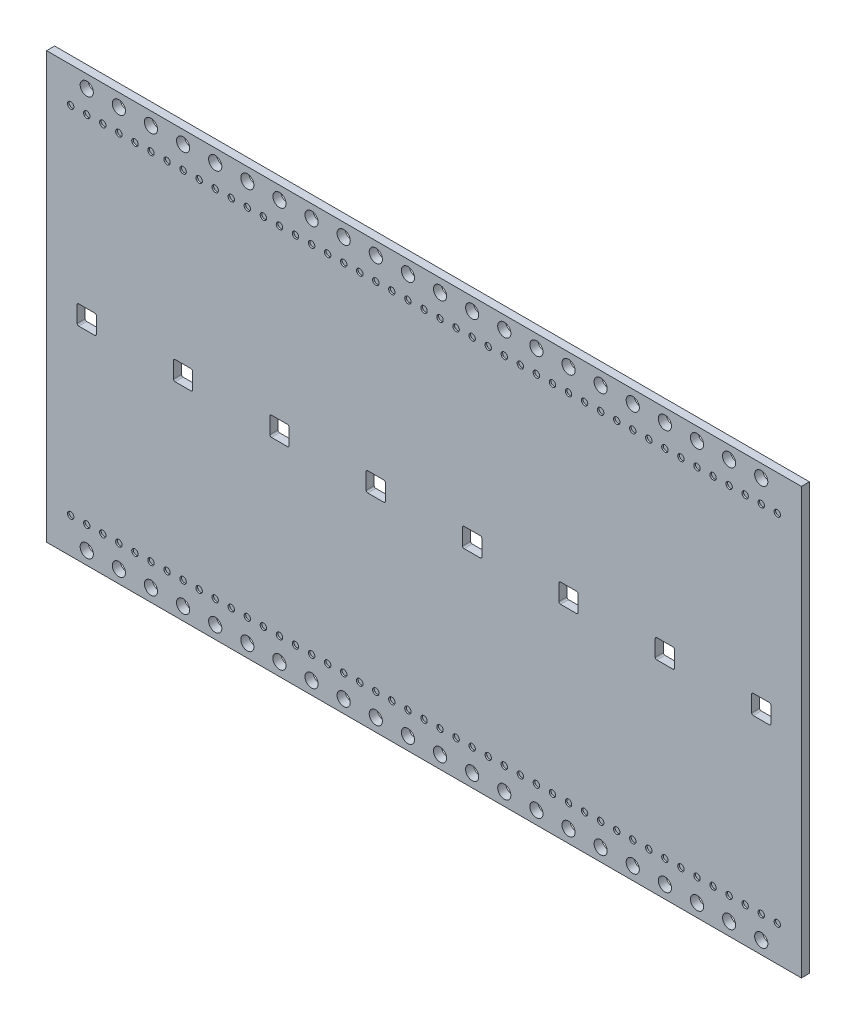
SolidWorks part; units mm, degrees
ref_plane "前视基准面" through (0, 0, 0) normal (0, 0, 1) x (1, 0, 0)
ref_plane "上视基准面" through (0, 0, 0) normal (0, 1, 0) x (1, 0, 0)
ref_plane "右视基准面" through (0, 0, 0) normal (1, 0, 0) x (0, 0, -1)
sketch "草图1" plane through (0, 0, 0) normal (0, 0, 1) x (1, 0, 0)
  line L0 (-117.5, 66.275) -> (117.5, 66.275)
  line L1 (117.5, -66.275) -> (-117.5, -66.275)
  line L2 (-117.5, -66.275) -> (-117.5, 66.275)
  line L3 (117.5, 66.275) -> (117.5, -66.275)
  line L4 (117.5, 66.275) -> (-117.5, -66.275) construction
  circle A0 centre (-105, 62.275) radius 2.05
  circle A1 centre (-95, 62.275) radius 2.05
  circle A2 centre (-95, -62.275) radius 2.05
  circle A3 centre (-85, 62.275) radius 2.05
  circle A4 centre (-85, -62.275) radius 2.05
  circle A5 centre (-75, 62.275) radius 2.05
  circle A6 centre (-75, -62.275) radius 2.05
  circle A7 centre (-65, 62.275) radius 2.05
  circle A8 centre (-65, -62.275) radius 2.05
  circle A9 centre (-55, 62.275) radius 2.05
  circle A10 centre (-55, -62.275) radius 2.05
  circle A11 centre (-45, 62.275) radius 2.05
  circle A12 centre (-45, -62.275) radius 2.05
  circle A13 centre (-35, 62.275) radius 2.05
  circle A14 centre (-35, -62.275) radius 2.05
  circle A15 centre (-25, 62.275) radius 2.05
  circle A16 centre (-25, -62.275) radius 2.05
  circle A17 centre (-15, 62.275) radius 2.05
  circle A18 centre (-15, -62.275) radius 2.05
  circle A19 centre (-5, 62.275) radius 2.05
  circle A20 centre (-5, -62.275) radius 2.05
  circle A21 centre (5, 62.275) radius 2.05
  circle A22 centre (5, -62.275) radius 2.05
  circle A23 centre (15, 62.275) radius 2.05
  circle A24 centre (15, -62.275) radius 2.05
  circle A25 centre (25, 62.275) radius 2.05
  circle A26 centre (25, -62.275) radius 2.05
  circle A27 centre (35, 62.275) radius 2.05
  circle A28 centre (35, -62.275) radius 2.05
  circle A29 centre (45, 62.275) radius 2.05
  circle A30 centre (45, -62.275) radius 2.05
  circle A31 centre (55, 62.275) radius 2.05
  circle A32 centre (55, -62.275) radius 2.05
  circle A33 centre (65, 62.275) radius 2.05
  circle A34 centre (65, -62.275) radius 2.05
  circle A35 centre (75, 62.275) radius 2.05
  circle A36 centre (75, -62.275) radius 2.05
  circle A37 centre (85, 62.275) radius 2.05
  circle A38 centre (85, -62.275) radius 2.05
  circle A39 centre (95, 62.275) radius 2.05
  circle A40 centre (95, -62.275) radius 2.05
  circle A41 centre (105, 62.275) radius 2.05
  circle A42 centre (105, -62.275) radius 2.05
  circle A52 centre (-105, -62.275) radius 2.05
extrude "凸台-拉伸1" add sketch "草图1" along normal mid plane 2.5
sketch "草图2" plane through (0, 0, 1.25) normal (0, 0, 1) x (1, 0, 0)
  line L0 (117.5, 66.275) -> (-117.5, 66.275) construction
  line L1 (-117.5, -66.275) -> (117.5, -66.275) construction
  circle A0 centre (-110, 55.275) radius 1
  circle A2 centre (-105, 62.275) radius 2.05 construction
  circle A3 centre (-110, -55.275) radius 1
  circle A4 centre (-105, 55.275) radius 1
  circle A5 centre (-105, -55.275) radius 1
  circle A6 centre (-100, 55.275) radius 1
  circle A7 centre (-100, -55.275) radius 1
  circle A8 centre (-95, 55.275) radius 1
  circle A9 centre (-95, -55.275) radius 1
  circle A10 centre (-90, 55.275) radius 1
  circle A11 centre (-90, -55.275) radius 1
  circle A12 centre (-85, 55.275) radius 1
  circle A13 centre (-85, -55.275) radius 1
  circle A14 centre (-80, 55.275) radius 1
  circle A15 centre (-80, -55.275) radius 1
  circle A16 centre (-75, 55.275) radius 1
  circle A17 centre (-75, -55.275) radius 1
  circle A18 centre (-70, 55.275) radius 1
  circle A19 centre (-70, -55.275) radius 1
  circle A20 centre (-65, 55.275) radius 1
  circle A21 centre (-65, -55.275) radius 1
  circle A22 centre (-60, 55.275) radius 1
  circle A23 centre (-60, -55.275) radius 1
  circle A24 centre (-55, 55.275) radius 1
  circle A25 centre (-55, -55.275) radius 1
  circle A26 centre (-50, 55.275) radius 1
  circle A27 centre (-50, -55.275) radius 1
  circle A28 centre (-45, 55.275) radius 1
  circle A29 centre (-45, -55.275) radius 1
  circle A30 centre (-40, 55.275) radius 1
  circle A31 centre (-40, -55.275) radius 1
  circle A32 centre (-35, 55.275) radius 1
  circle A33 centre (-35, -55.275) radius 1
  circle A34 centre (-30, 55.275) radius 1
  circle A35 centre (-30, -55.275) radius 1
  circle A36 centre (-25, 55.275) radius 1
  circle A37 centre (-25, -55.275) radius 1
  circle A38 centre (-20, 55.275) radius 1
  circle A39 centre (-20, -55.275) radius 1
  circle A40 centre (-15, 55.275) radius 1
  circle A41 centre (-15, -55.275) radius 1
  circle A42 centre (-10, 55.275) radius 1
  circle A43 centre (-10, -55.275) radius 1
  circle A44 centre (-5, 55.275) radius 1
  circle A45 centre (-5, -55.275) radius 1
  circle A46 centre (0, 55.275) radius 1
  circle A47 centre (0, -55.275) radius 1
  circle A48 centre (5, 55.275) radius 1
  circle A49 centre (5, -55.275) radius 1
  circle A50 centre (10, 55.275) radius 1
  circle A51 centre (10, -55.275) radius 1
  circle A52 centre (15, 55.275) radius 1
  circle A53 centre (15, -55.275) radius 1
  circle A54 centre (20, 55.275) radius 1
  circle A55 centre (20, -55.275) radius 1
  circle A56 centre (25, 55.275) radius 1
  circle A57 centre (25, -55.275) radius 1
  circle A58 centre (30, 55.275) radius 1
  circle A59 centre (30, -55.275) radius 1
  circle A60 centre (35, 55.275) radius 1
  circle A61 centre (35, -55.275) radius 1
  circle A62 centre (40, 55.275) radius 1
  circle A63 centre (40, -55.275) radius 1
  circle A64 centre (45, 55.275) radius 1
  circle A65 centre (45, -55.275) radius 1
  circle A66 centre (50, 55.275) radius 1
  circle A67 centre (50, -55.275) radius 1
  circle A68 centre (55, 55.275) radius 1
  circle A69 centre (55, -55.275) radius 1
  circle A70 centre (60, 55.275) radius 1
  circle A71 centre (60, -55.275) radius 1
  circle A72 centre (65, 55.275) radius 1
  circle A73 centre (65, -55.275) radius 1
  circle A74 centre (70, 55.275) radius 1
  circle A75 centre (70, -55.275) radius 1
  circle A76 centre (75, 55.275) radius 1
  circle A77 centre (75, -55.275) radius 1
  circle A78 centre (80, 55.275) radius 1
  circle A79 centre (80, -55.275) radius 1
  circle A80 centre (85, 55.275) radius 1
  circle A81 centre (85, -55.275) radius 1
  circle A82 centre (90, 55.275) radius 1
  circle A83 centre (90, -55.275) radius 1
  circle A84 centre (95, 55.275) radius 1
  circle A85 centre (95, -55.275) radius 1
  circle A86 centre (100, 55.275) radius 1
  circle A87 centre (100, -55.275) radius 1
  circle A88 centre (105, 55.275) radius 1
  circle A89 centre (105, -55.275) radius 1
  circle A90 centre (110, 55.275) radius 1
  circle A91 centre (110, -55.275) radius 1
extrude "切除-拉伸1" cut sketch "草图2" against normal blind 0.5
sketch "草图3" plane through (0, 0, -1.25) normal (0, 0, -1) x (-1, 0, 0)
  circle A0 centre (110, 55.275) radius 1
  circle A1 centre (110, -55.275) radius 1
  circle A2 centre (105, 55.275) radius 1
  circle A3 centre (105, -55.275) radius 1
  circle A4 centre (100, 55.275) radius 1
  circle A5 centre (100, -55.275) radius 1
  circle A6 centre (95, 55.275) radius 1
  circle A7 centre (95, -55.275) radius 1
  circle A8 centre (90, 55.275) radius 1
  circle A9 centre (90, -55.275) radius 1
  circle A10 centre (85, 55.275) radius 1
  circle A11 centre (85, -55.275) radius 1
  circle A12 centre (80, 55.275) radius 1
  circle A13 centre (80, -55.275) radius 1
  circle A14 centre (75, 55.275) radius 1
  circle A15 centre (75, -55.275) radius 1
  circle A16 centre (70, 55.275) radius 1
  circle A17 centre (70, -55.275) radius 1
  circle A18 centre (65, 55.275) radius 1
  circle A19 centre (65, -55.275) radius 1
  circle A20 centre (60, 55.275) radius 1
  circle A21 centre (60, -55.275) radius 1
  circle A22 centre (55, 55.275) radius 1
  circle A23 centre (55, -55.275) radius 1
  circle A24 centre (50, 55.275) radius 1
  circle A25 centre (50, -55.275) radius 1
  circle A26 centre (45, 55.275) radius 1
  circle A27 centre (45, -55.275) radius 1
  circle A28 centre (40, 55.275) radius 1
  circle A29 centre (40, -55.275) radius 1
  circle A30 centre (35, 55.275) radius 1
  circle A31 centre (35, -55.275) radius 1
  circle A32 centre (30, 55.275) radius 1
  circle A33 centre (30, -55.275) radius 1
  circle A34 centre (25, 55.275) radius 1
  circle A35 centre (25, -55.275) radius 1
  circle A36 centre (20, 55.275) radius 1
  circle A37 centre (20, -55.275) radius 1
  circle A38 centre (15, 55.275) radius 1
  circle A39 centre (15, -55.275) radius 1
  circle A40 centre (10, 55.275) radius 1
  circle A41 centre (10, -55.275) radius 1
  circle A42 centre (5, 55.275) radius 1
  circle A43 centre (5, -55.275) radius 1
  circle A44 centre (0, 55.275) radius 1
  circle A45 centre (0, -55.275) radius 1
  circle A46 centre (-5, 55.275) radius 1
  circle A47 centre (-5, -55.275) radius 1
  circle A48 centre (-10, 55.275) radius 1
  circle A49 centre (-10, -55.275) radius 1
  circle A50 centre (-15, 55.275) radius 1
  circle A51 centre (-15, -55.275) radius 1
  circle A52 centre (-20, 55.275) radius 1
  circle A53 centre (-20, -55.275) radius 1
  circle A54 centre (-25, 55.275) radius 1
  circle A55 centre (-25, -55.275) radius 1
  circle A56 centre (-30, 55.275) radius 1
  circle A57 centre (-30, -55.275) radius 1
  circle A58 centre (-35, 55.275) radius 1
  circle A59 centre (-35, -55.275) radius 1
  circle A60 centre (-40, 55.275) radius 1
  circle A61 centre (-40, -55.275) radius 1
  circle A62 centre (-45, 55.275) radius 1
  circle A63 centre (-45, -55.275) radius 1
  circle A64 centre (-50, 55.275) radius 1
  circle A65 centre (-50, -55.275) radius 1
  circle A66 centre (-55, 55.275) radius 1
  circle A67 centre (-55, -55.275) radius 1
  circle A68 centre (-60, 55.275) radius 1
  circle A69 centre (-60, -55.275) radius 1
  circle A70 centre (-65, 55.275) radius 1
  circle A71 centre (-65, -55.275) radius 1
  circle A72 centre (-70, 55.275) radius 1
  circle A73 centre (-70, -55.275) radius 1
  circle A74 centre (-75, 55.275) radius 1
  circle A75 centre (-75, -55.275) radius 1
  circle A76 centre (-80, 55.275) radius 1
  circle A77 centre (-80, -55.275) radius 1
  circle A78 centre (-85, 55.275) radius 1
  circle A79 centre (-85, -55.275) radius 1
  circle A80 centre (-90, 55.275) radius 1
  circle A81 centre (-90, -55.275) radius 1
  circle A82 centre (-95, 55.275) radius 1
  circle A83 centre (-95, -55.275) radius 1
  circle A84 centre (-100, 55.275) radius 1
  circle A85 centre (-100, -55.275) radius 1
  circle A86 centre (-105, 55.275) radius 1
  circle A87 centre (-105, -55.275) radius 1
  circle A88 centre (-110, 55.275) radius 1
  circle A89 centre (-110, -55.275) radius 1
extrude "凸台-拉伸2" add sketch "草图3" along normal blind 1
sketch "草图4" plane through (0, 0, 1.25) normal (0, 0, 1) x (1, 0, 0)
  line L0 (-117.5, 66.275) -> (-117.5, -66.275) construction
  line L1 (-107.5, -3) -> (-102.5, -3)
  line L2 (-108, -2.5) -> (-108, 2.5)
  line L3 (-107.5, 3) -> (-102.5, 3)
  line L4 (-102, -2.5) -> (-102, 2.5)
  line L5 (-108, -3) -> (-102, 3) construction
  line L6 (-108, 3) -> (-102, -3) construction
  line L8 (117.5, 66.275) -> (-117.5, 66.275) construction
  line L9 (-117.5, -66.275) -> (117.5, -66.275) construction
  line L10 (-77.5, 3) -> (-72.5, 3)
  line L11 (-78, -2.5) -> (-78, 2.5)
  line L12 (-77.5, -3) -> (-72.5, -3)
  line L13 (-72, -2.5) -> (-72, 2.5)
  line L14 (-47.5, 3) -> (-42.5, 3)
  line L15 (-48, -2.5) -> (-48, 2.5)
  line L16 (-47.5, -3) -> (-42.5, -3)
  line L17 (-42, -2.5) -> (-42, 2.5)
  line L18 (-17.5, 3) -> (-12.5, 3)
  line L19 (-18, -2.5) -> (-18, 2.5)
  line L20 (-17.5, -3) -> (-12.5, -3)
  line L21 (-12, -2.5) -> (-12, 2.5)
  line L22 (12.5, 3) -> (17.5, 3)
  line L23 (12, -2.5) -> (12, 2.5)
  line L24 (12.5, -3) -> (17.5, -3)
  line L25 (18, -2.5) -> (18, 2.5)
  line L26 (42.5, 3) -> (47.5, 3)
  line L27 (42, -2.5) -> (42, 2.5)
  line L28 (42.5, -3) -> (47.5, -3)
  line L29 (48, -2.5) -> (48, 2.5)
  line L30 (72.5, 3) -> (77.5, 3)
  line L31 (72, -2.5) -> (72, 2.5)
  line L32 (72.5, -3) -> (77.5, -3)
  line L33 (78, -2.5) -> (78, 2.5)
  line L34 (102.5, 3) -> (107.5, 3)
  line L35 (102, -2.5) -> (102, 2.5)
  line L36 (102.5, -3) -> (107.5, -3)
  line L37 (108, -2.5) -> (108, 2.5)
  arc A0 (-107.5, 3) -> (-108, 2.5) centre (-107.5, 2.5) ccw
  arc A1 (-108, -2.5) -> (-107.5, -3) centre (-107.5, -2.5) ccw
  arc A2 (-102.5, -3) -> (-102, -2.5) centre (-102.5, -2.5) ccw
  arc A3 (-102, 2.5) -> (-102.5, 3) centre (-102.5, 2.5) ccw
  arc A4 (-77.5, 3) -> (-78, 2.5) centre (-77.5, 2.5) ccw
  arc A5 (-78, -2.5) -> (-77.5, -3) centre (-77.5, -2.5) ccw
  arc A6 (-72.5, -3) -> (-72, -2.5) centre (-72.5, -2.5) ccw
  arc A7 (-72, 2.5) -> (-72.5, 3) centre (-72.5, 2.5) ccw
  arc A8 (-47.5, 3) -> (-48, 2.5) centre (-47.5, 2.5) ccw
  arc A9 (-48, -2.5) -> (-47.5, -3) centre (-47.5, -2.5) ccw
  arc A10 (-42.5, -3) -> (-42, -2.5) centre (-42.5, -2.5) ccw
  arc A11 (-42, 2.5) -> (-42.5, 3) centre (-42.5, 2.5) ccw
  arc A12 (-17.5, 3) -> (-18, 2.5) centre (-17.5, 2.5) ccw
  arc A13 (-18, -2.5) -> (-17.5, -3) centre (-17.5, -2.5) ccw
  arc A14 (-12.5, -3) -> (-12, -2.5) centre (-12.5, -2.5) ccw
  arc A15 (-12, 2.5) -> (-12.5, 3) centre (-12.5, 2.5) ccw
  arc A16 (12.5, 3) -> (12, 2.5) centre (12.5, 2.5) ccw
  arc A17 (12, -2.5) -> (12.5, -3) centre (12.5, -2.5) ccw
  arc A18 (17.5, -3) -> (18, -2.5) centre (17.5, -2.5) ccw
  arc A19 (18, 2.5) -> (17.5, 3) centre (17.5, 2.5) ccw
  arc A20 (42.5, 3) -> (42, 2.5) centre (42.5, 2.5) ccw
  arc A21 (42, -2.5) -> (42.5, -3) centre (42.5, -2.5) ccw
  arc A22 (47.5, -3) -> (48, -2.5) centre (47.5, -2.5) ccw
  arc A23 (48, 2.5) -> (47.5, 3) centre (47.5, 2.5) ccw
  arc A24 (72.5, 3) -> (72, 2.5) centre (72.5, 2.5) ccw
  arc A25 (72, -2.5) -> (72.5, -3) centre (72.5, -2.5) ccw
  arc A26 (77.5, -3) -> (78, -2.5) centre (77.5, -2.5) ccw
  arc A27 (78, 2.5) -> (77.5, 3) centre (77.5, 2.5) ccw
  arc A28 (102.5, 3) -> (102, 2.5) centre (102.5, 2.5) ccw
  arc A29 (102, -2.5) -> (102.5, -3) centre (102.5, -2.5) ccw
  arc A30 (107.5, -3) -> (108, -2.5) centre (107.5, -2.5) ccw
  arc A31 (108, 2.5) -> (107.5, 3) centre (107.5, 2.5) ccw
  point P0 (-105, 0)
  dimension "D6" = 0.5
  dimension "D1" = 9.5
  dimension "D2" = 6
  dimension "D3" = 6
  dimension "D4" = 66.275
  dimension "D5" = 66.275
  dimension "D7" = 8
extrude "切除-拉伸2" cut sketch "草图4" against normal blind 10
equation "\"D4@草图1\"=\"D1@草图1\"/2"
equation "\"D3@草图1\"=\"D2@草图1\"/2"
equation "\"D9@草图1\"=\"D1@草图1\"/10-2"
equation "\"D5@草图2\"=\"D1@草图1\"/5-2"
equation "\"D1@草图3\"=\"D1@草图1\"/5-2"
